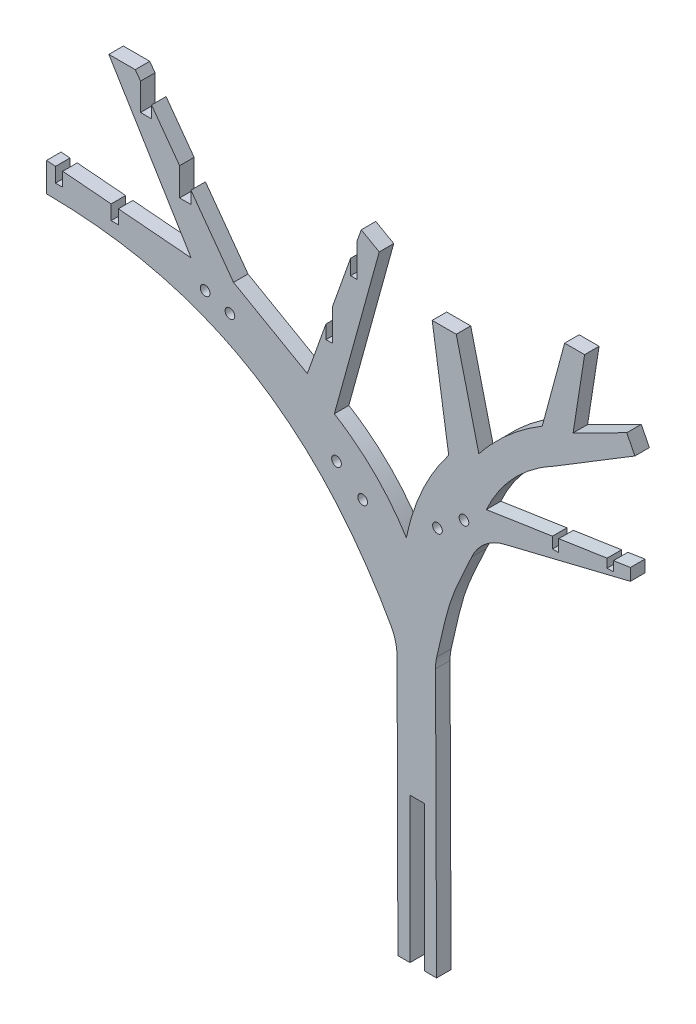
SolidWorks part; units mm, degrees
ref_plane "Plan de face" through (0, 0, 0) normal (0, 0, 1) x (1, 0, 0)
ref_plane "Plan de dessus" through (0, 0, 0) normal (0, 1, 0) x (1, 0, 0)
ref_plane "Plan de droite" through (0, 0, 0) normal (1, 0, 0) x (0, 0, -1)
sketch "Esquisse1" plane through (0, 0, 0) normal (0, 0, 1) x (1, 0, 0)
  line L0 (2.3511, 112.1633) -> (2.1775, 165.7435)
  line L26 (6.3123, 62.4707) -> (6.3123, 126.3454) construction
  line L27 (10.3511, 112.1633) -> (10.132, 167.4219)
  line L28 (-70.3001, 212.2785) -> (-70.3001, 218.2785)
  line L29 (-70.3001, 218.2785) -> (-40.4167, 215.754)
  line L30 (-40.4167, 215.754) -> (-57.4328, 243.6942)
  line L31 (-57.4328, 243.6942) -> (-51.9703, 243.6942)
  line L32 (-51.9703, 243.6942) -> (-31.6457, 215.754)
  line L33 (-16.3778, 207.0377) -> (-5.2173, 238.3894)
  line L34 (-5.2173, 238.3894) -> (-1.5106, 236.2739)
  line L35 (-1.5106, 236.2739) -> (-10.7937, 202.6424)
  line L36 (12.8538, 207.0377) -> (9.4392, 229.4916)
  line L37 (9.4392, 229.4916) -> (14.4129, 229.4916)
  line L38 (14.4129, 229.4916) -> (19.0919, 210.4084)
  line L39 (32.1979, 221.9272) -> (36.8329, 239.1137)
  line L40 (36.8329, 239.1137) -> (40.9623, 239.1137)
  line L41 (40.9623, 239.1137) -> (38.5861, 223.9048)
  line L42 (49.685, 229.4916) -> (51.3622, 226.1597)
  line L43 (51.3622, 226.1597) -> (34.5613, 215.9275)
  line L44 (20.6343, 201.1979) -> (50.4311, 205.7291)
  line L45 (50.4311, 205.7291) -> (50.4311, 203.2421)
  line L46 (50.4311, 203.2421) -> (24.3642, 196.8508)
  line L47 (2.3511, 112.1633) -> (10.3511, 112.1633)
  arc A15 (24.3642, 196.8508) -> (17.6108, 191.2074) centre (26.7455, 187.1385) ccw
  arc A16 (10.132, 167.4219) -> (10.3749, 169.6525) centre (20.1319, 167.4615) cw
  arc A17 (2.1775, 165.7435) -> (0.9545, 170.4792) centre (-7.7271, 165.7114) ccw
  spline S0 degree 3 poles (0.9545, 170.4792) (-1.2284, 174.4541) (-17.8927, 200.2965) (-42.1501, 212.0934) (-70.3001, 212.2785) knots 0.022769 0.022769 0.022769 0.022769 0.195051 1 1 1 1
  spline S1 degree 1 poles (-31.6457, 215.754) (-16.3778, 207.0377) knots 0 0 1 1
  spline S2 degree 2 poles (-10.7937, 202.6424) (-1.6054, 197.0096) (4.1086, 187.8736) knots 0 0 0 1 1 1
  spline S3 degree 2 poles (4.1086, 187.8736) (6.2382, 198.4955) (12.8538, 207.0377) knots 0 0 0 1 1 1
  spline S4 degree 2 poles (19.0919, 210.4084) (24.6018, 217.3894) (32.1979, 221.9272) knots 0 0 0 1 1 1
  spline S5 degree 2 poles (38.5861, 223.9048) (44.1356, 226.6982) (49.685, 229.4916) knots 0 0 0 1 1 1
  spline S6 degree 2 poles (34.5613, 215.9275) (24.9962, 210.7562) (20.6343, 201.1979) knots 0 0 0 1 1 1
  spline S7 degree 3 poles (17.6108, 191.2074) (16.0957, 187.8061) (13.3154, 182.0265) (12.3606, 178.4954) (10.3749, 169.6525) knots 0.094316 0.094316 0.094316 0.094316 0.397348 0.983635 0.983635 0.983635 0.983635
  dimension "D1" = 9.9047
  dimension "D4" = 10
  dimension "D3" = 10
  dimension "D2" = 6
  dimension "D5" = 5.4625
  dimension "D6" = 8
extrude "Boss.-Extru.1" add sketch "Esquisse1" along normal blind 3
sketch "Esquisse2" plane through (0, 0, 3) normal (0, 0, 1) x (1, 0, 0)
  line L0 (-40.4167, 215.754) -> (-70.3001, 218.2785) construction
  line L1 (-68.4628, 218.1233) -> (-66.9628, 218.1233)
  line L2 (-68.4628, 218.1233) -> (-68.4628, 215.1233)
  line L3 (-68.4628, 215.1233) -> (-66.9628, 215.1233)
  line L4 (-66.9628, 218.1233) -> (-66.9628, 215.1233)
  line L6 (-56.9628, 217.1518) -> (-55.4628, 217.1518)
  line L7 (-56.9628, 217.1518) -> (-56.9628, 214.1518)
  line L8 (-56.9628, 214.1518) -> (-55.4628, 214.1518)
  line L9 (-55.4628, 217.1518) -> (-55.4628, 214.1518)
  line L22 (50.4311, 205.7291) -> (20.6343, 201.1979) construction
  line L23 (46.9134, 205.1941) -> (45.6134, 205.1941)
  line L24 (46.9134, 205.1941) -> (46.9134, 203.1941)
  line L25 (46.9134, 203.1941) -> (45.6134, 203.1941)
  line L26 (45.6134, 205.1941) -> (45.6134, 203.1941)
  line L27 (-5.2173, 238.3894) -> (-16.3778, 207.0377) construction
  line L28 (35.6134, 203.4757) -> (34.3134, 203.4757)
  line L29 (35.6134, 203.4757) -> (35.6134, 200.9757)
  line L30 (35.6134, 200.9757) -> (34.3134, 200.9757)
  line L31 (34.3134, 203.4757) -> (34.3134, 200.9757)
  line L32 (-6.1229, 235.8454) -> (-7.4229, 235.8454)
  line L33 (-6.1229, 235.8454) -> (-6.1229, 229.0551)
  line L34 (-6.1229, 229.0551) -> (-7.4229, 229.0551)
  line L35 (-7.4229, 235.8454) -> (-7.4229, 229.0551)
  line L36 (-31.6457, 215.754) -> (-51.9703, 243.6942) construction
  line L37 (-11.2238, 221.5163) -> (-12.5238, 221.5163)
  line L38 (-11.2238, 221.5163) -> (-11.2238, 215.0603)
  line L39 (-11.2238, 215.0603) -> (-12.5238, 215.0603)
  line L40 (-12.5238, 221.5163) -> (-12.5238, 215.0603)
  line L41 (-50.87, 242.1816) -> (-48.5974, 242.1816)
  line L42 (-50.87, 242.1816) -> (-50.87, 236.5704)
  line L43 (-50.87, 236.5704) -> (-48.5974, 236.5704)
  line L44 (-48.5974, 242.1816) -> (-48.5974, 236.5704)
  line L46 (-42.7936, 231.0789) -> (-40.4548, 231.0789)
  line L47 (-42.7936, 231.0789) -> (-42.7936, 225.2961)
  line L48 (-42.7936, 225.2961) -> (-40.4548, 225.2961)
  line L49 (-40.4548, 231.0789) -> (-40.4548, 225.2961)
  circle A0 centre (-37.5165, 211.3561) radius 1
  circle A1 centre (-32.3899, 209.8136) radius 1
  circle A2 centre (-10.3525, 194.3506) radius 1
  circle A3 centre (-4.9324, 190.1987) radius 1
  circle A4 centre (10.5349, 192.8426) radius 1
  circle A5 centre (16.012, 197.0098) radius 1
  point P32 (45.6134, 204.1941)
  dimension "D1" = 2
  dimension "D2" = 2
  dimension "D3" = 2
  dimension "D4" = 1.5
  dimension "D5" = 3
  dimension "D6" = 1.5
  dimension "D7" = 3
  dimension "D8" = 10
  dimension "D9" = 1.3
  dimension "D10" = 2
  dimension "D11" = 1.3
  dimension "D12" = 2.5
  dimension "D13" = 10
  dimension "D14" = 1.3
  dimension "D15" = 1.3
extrude "Enlèv. mat.-Extru.1" cut sketch "Esquisse2" against normal blind 3
sketch "Esquisse3" plane through (0, 0, 3) normal (0, 0, 1) x (1, 0, 0)
  line L0 (2.3511, 112.1633) -> (10.3511, 112.1633) construction
  line L1 (7.8511, 112.1633) -> (4.8511, 112.1633)
  line L2 (7.8511, 112.1633) -> (7.8511, 142.1633)
  line L3 (7.8511, 142.1633) -> (4.8511, 142.1633)
  line L4 (4.8511, 112.1633) -> (4.8511, 142.1633)
  line L5 (6.3511, 112.1633) -> (6.3511, 154.1683) construction
  point P8 (6.322, 112.1633)
  dimension "D1" = 30
  dimension "D2" = 3
extrude "Enlèv. mat.-Extru.2" cut sketch "Esquisse3" against normal blind 10
